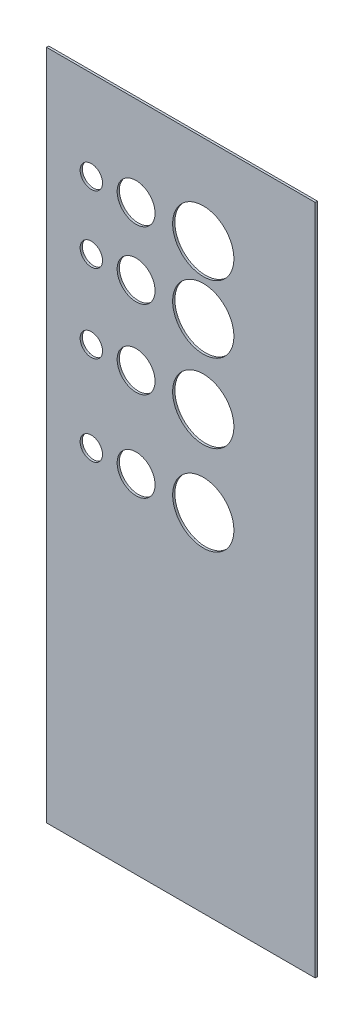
SolidWorks part; units mm, degrees
ref_plane "Ebene vorne" through (0, 0, 0) normal (0, 0, 1) x (1, 0, 0)
ref_plane "Ebene oben" through (0, 0, 0) normal (0, 1, 0) x (1, 0, 0)
ref_plane "Ebene rechts" through (0, 0, 0) normal (1, 0, 0) x (0, 0, -1)
sketch "Skizze1" plane through (0, 0, 0) normal (0, 0, 1) x (1, 0, 0)
  line L1 (0, 0) -> (600, 0)
  line L2 (0, 0) -> (0, 1500)
  line L3 (0, 1500) -> (600, 1500)
  line L4 (600, 0) -> (600, 1500)
  dimension "D6" = 1500
  dimension "D7" = 600
extrude "Linear austragen1" add sketch "Skizze1" along normal blind 5 contours L1 L4 L3 L2
sketch "Skizze2" plane through (0, 0, 5) normal (0, 0, 1) x (1, 0, 0)
  line L0 (0, 0) -> (0, 1500) construction
  line L1 (0, 1500) -> (600, 1500) construction
  line L2 (100, 1300) -> (0, 1300) construction
  line L3 (0, 1307.753) -> (600, 1413.5492) construction
  line L4 (0, 1292.247) -> (600, 1186.4508) construction
  line L5 (0, 1300) -> (0, 1307.753) construction
  line L6 (0, 1300) -> (0, 1292.247) construction
  line L8 (600, 0) -> (600, 1500) construction
  circle A0 centre (100, 1300) radius 25
  dimension "D1" = 50
  dimension "D3" = 200
  dimension "D2" = 100
  dimension "Winkel" = 20
  dimension "Basis" = 15.5059
extrude "Schnitt-Linear austragen2" cut sketch "Skizze2" against normal blind 10
pattern_linear "Lineares Muster1" count 2 spacing 100 along (1, 0, 0) of "Schnitt-Linear austragen2"
pattern_linear "Lineares Muster2" count 2 spacing 250 along (1, 0, 0) of "Schnitt-Linear austragen2"
other "TMuster1" parameters "D0"=100, "T-Musterabstand-1"=1150, "D2"=100, "T-Musterabstand-2"=975, "D4"=100, "T-Musterabstand-3"=775
equation "\"FAKTOR DM\"=2"
equation "\"FAKTOR AB\"=1.5"
